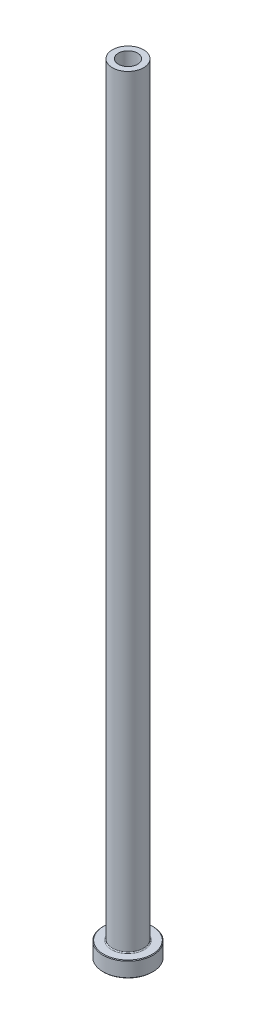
SolidWorks part; units mm, degrees
ref_plane "Front Plane" through (0, 0, 0) normal (0, 0, 1) x (1, 0, 0)
ref_plane "Top Plane" through (0, 0, 0) normal (0, 1, 0) x (1, 0, 0)
ref_plane "Right Plane" through (0, 0, 0) normal (1, 0, 0) x (0, 0, -1)
sketch "Sketch1" plane through (0, 0, 0) normal (0, 0, 1) x (1, 0, 0)
  line L0 (-3.1, 250) -> (-5, 250)
  line L1 (-5, 250) -> (-5, 5)
  line L2 (-5, 5) -> (-8, 5)
  line L3 (-8, 5) -> (-8, 0)
  line L4 (8.8, 0) -> (-8.8, 0) construction
  line L5 (-8, 0) -> (-3.35, 0)
  line L6 (-3.1, 205) -> (-3.1, 250)
  line L7 (0, 92.1877) -> (0, -15.5353) construction
  line L8 (0, -8.8) -> (0, 8.8) construction
  line L9 (-3.1, 205) -> (-3.35, 193)
  line L10 (-3.35, 193) -> (-3.35, 0)
  dimension "D1" = 0.25
  dimension "ID" = 6.2
  dimension "OD" = 10
  dimension "L" = 250
  dimension "H" = 16
  dimension "T" = 5
  dimension "N" = 45
  dimension "D2" = 12
revolve "Revolve1" add sketch "Sketch1" angle 360 about L7
fillet "Fillet1" radius 0.3 1 edges at (0, 5, 5)
chamfer "Chamfer1" distance 0.2 angle 45 2 edges at (0, 5, 8) (0, 0, 8)
chamfer "Chamfer3" distance 0.5 angle 45 1 edges at (0, 0, 3.35)
